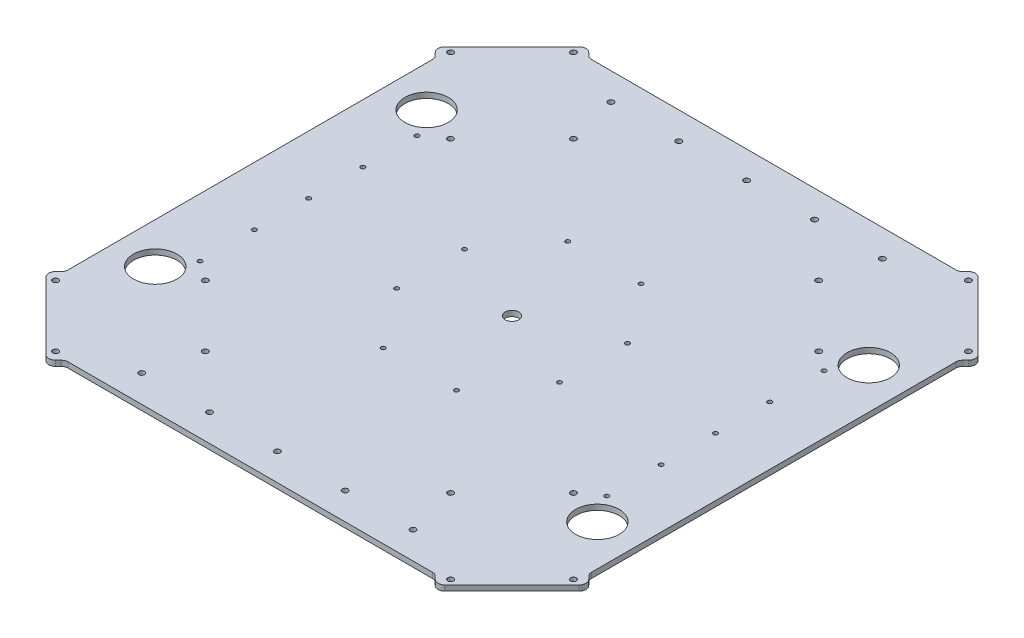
SolidWorks part; units mm, degrees
ref_plane "前视基准面" through (0, 0, 0) normal (0, 0, 1) x (1, 0, 0)
ref_plane "上视基准面" through (0, 0, 0) normal (0, 1, 0) x (1, 0, 0)
ref_plane "右视基准面" through (0, 0, 0) normal (1, 0, 0) x (0, 0, -1)
sketch "草图1" plane through (0, 0, 0) normal (0, 1, 0) x (1, 0, 0)
  line L0 (-143.4315, 200) -> (-200, 143.4315)
  line L1 (-200, 200) -> (200, 200)
  line L2 (-200, 200) -> (-200, -200)
  line L3 (-200, -200) -> (200, -200)
  line L4 (200, 200) -> (200, -200)
  line L5 (-200, 200) -> (200, -200) construction
  line L6 (-200, -200) -> (200, 200) construction
  line L7 (200, 143.4315) -> (143.4315, 200)
  line L8 (143.4315, -200) -> (200, -143.4315)
  line L9 (-200, -143.4315) -> (-143.4315, -200)
  point P17 (0, 0)
  dimension "D1" = 400
  dimension "D2" = 400
  dimension "D3" = 45
  dimension "D4" = 4
  dimension "D5" = 40
extrude "凸台-拉伸1" add sketch "草图1" along normal blind 4 contours L2 L9 L3 L8 L4 L7 L1 L0
sketch "草图2" plane through (0, 4, 0) normal (0, 1, 0) x (1, 0, 0)
  line L0 (-145.5528, 190.8076) -> (-190.8076, 145.5528) construction
  line L1 (-143.4315, 200) -> (-200, 143.4315) construction
  line L2 (-171.7157, 171.7157) -> (-94.1279, 94.1279) construction
  line L3 (-90.3984, 135.6533) -> (-135.6533, 90.3984) construction
  line L4 (190.8076, 145.5528) -> (145.5528, 190.8076) construction
  line L5 (171.7157, 171.7157) -> (94.1279, 94.1279) construction
  line L6 (135.6533, 90.3984) -> (90.3984, 135.6533) construction
  line L7 (145.5528, -190.8076) -> (190.8076, -145.5528) construction
  line L8 (171.7157, -171.7157) -> (94.1279, -94.1279) construction
  line L9 (90.3984, -135.6533) -> (135.6533, -90.3984) construction
  line L10 (-190.8076, -145.5528) -> (-145.5528, -190.8076) construction
  line L11 (-171.7157, -171.7157) -> (-94.1279, -94.1279) construction
  line L12 (-135.6533, -90.3984) -> (-90.3984, -135.6533) construction
  circle A0 centre (-190.8076, 145.5528) radius 2.1
  circle A1 centre (-145.5528, 190.8076) radius 2.1
  circle A2 centre (-135.6533, 90.3984) radius 2.1
  circle A3 centre (-90.3984, 135.6533) radius 2.1
  circle A4 centre (145.5528, 190.8076) radius 2.1
  circle A5 centre (190.8076, 145.5528) radius 2.1
  circle A6 centre (90.3984, 135.6533) radius 2.1
  circle A7 centre (135.6533, 90.3984) radius 2.1
  circle A8 centre (190.8076, -145.5528) radius 2.1
  circle A9 centre (145.5528, -190.8076) radius 2.1
  circle A10 centre (135.6533, -90.3984) radius 2.1
  circle A11 centre (90.3984, -135.6533) radius 2.1
  circle A12 centre (-145.5528, -190.8076) radius 2.1
  circle A13 centre (-190.8076, -145.5528) radius 2.1
  circle A14 centre (-90.3984, -135.6533) radius 2.1
  circle A15 centre (-135.6533, -90.3984) radius 2.1
  point P8 (-168.1802, 168.1802)
  point P46 (0, 0)
  dimension "D1" = 4.2
  dimension "D2" = 4.2
  dimension "D3" = 5
  dimension "D4" = 64
  dimension "D6" = 78
  dimension "D8" = 78
  dimension "D5" = 2
  dimension "D7" = 4
extrude "切除-拉伸1" cut sketch "草图2" against normal through all
sketch "草图3" plane through (0, 4, 0) normal (0, 1, 0) x (1, 0, 0)
  line L0 (-200, 143.4315) -> (-192.9289, 136.3604)
  line L1 (-192.9289, 136.3604) -> (-192.9289, -136.3604)
  line L2 (0, 0) -> (-200, 0) construction
  line L3 (-200, 143.4315) -> (-200, -143.4315) construction
  line L4 (-200, -143.4315) -> (-192.9289, -136.3604)
  line L5 (143.4315, 200) -> (136.3604, 192.9289)
  line L6 (136.3604, 192.9289) -> (-136.3604, 192.9289)
  line L7 (-143.4315, 200) -> (-136.3604, 192.9289)
  line L8 (200, -143.4315) -> (192.9289, -136.3604)
  line L9 (192.9289, -136.3604) -> (192.9289, 136.3604)
  line L10 (200, 143.4315) -> (192.9289, 136.3604)
  line L11 (-143.4315, -200) -> (-136.3604, -192.9289)
  line L12 (-136.3604, -192.9289) -> (136.3604, -192.9289)
  line L13 (143.4315, -200) -> (136.3604, -192.9289)
  line L22 (-200, 143.4315) -> (-200, -143.4315)
  line L23 (-200, -143.4315) -> (-143.4315, -200)
  line L24 (-143.4315, -200) -> (143.4315, -200)
  line L25 (143.4315, -200) -> (200, -143.4315)
  line L26 (200, -143.4315) -> (200, 143.4315)
  line L27 (200, 143.4315) -> (143.4315, 200)
  line L28 (143.4315, 200) -> (-143.4315, 200)
  line L29 (-143.4315, 200) -> (-200, 143.4315)
  line L30 (-200, 143.4315) -> (-200, -143.4315)
  line L32 (-143.4315, -200) -> (143.4315, -200)
  line L34 (200, -143.4315) -> (200, 143.4315)
  line L36 (143.4315, 200) -> (-143.4315, 200)
  point P10 (-192.9289, 0)
  point P18 (0, 192.9289)
  point P23 (192.9289, 0)
  point P28 (0, -192.9289)
  point P29 (0, 0)
  dimension "D1" = 10
  dimension "D3" = 0
  dimension "D2" = 4
extrude "切除-拉伸2" cut sketch "草图3" against normal through all
sketch "草图4" plane through (0, 4, 0) normal (0, 1, 0) x (1, 0, 0)
  circle A0 centre (0, 0) radius 5
  dimension "D1" = 10
extrude "切除-拉伸3" cut sketch "草图4" against normal through all
sketch "草图5" plane through (0, 0, 0) normal (0, -1, 0) x (1, 0, 0)
  line L0 (0, 192.9289) -> (0, -192.9289) construction
  line L1 (136.3604, 192.9289) -> (-136.3604, 192.9289) construction
  line L2 (-136.3604, -192.9289) -> (136.3604, -192.9289) construction
  line L5 (192.9289, -136.3604) -> (192.9289, 136.3604) construction
  circle A0 centre (162.9289, 100) radius 16
  circle A1 centre (162.9289, -100) radius 16
  circle A4 centre (-162.9289, -100) radius 16
  circle A5 centre (-162.9289, 100) radius 16
  dimension "D1" = 32
  dimension "D2" = 32
  dimension "D3" = 200
  dimension "D4" = 30
extrude "切除-拉伸4" cut sketch "草图5" against normal through all
sketch "草图6" plane through (0, 0, 0) normal (0, -1, 0) x (1, 0, 0)
  line L1 (0, 192.9289) -> (0, -192.9289) construction
  line L2 (136.3604, 192.9289) -> (-136.3604, 192.9289) construction
  line L3 (-136.3604, -192.9289) -> (136.3604, -192.9289) construction
  circle A0 centre (-149.9289, 80) radius 1.6
  circle A11 centre (-162.9289, 100) radius 16 construction
  circle A12 centre (-149.9289, 40) radius 1.6
  circle A13 centre (-149.9289, 0) radius 1.6
  circle A14 centre (-149.9289, -40) radius 1.6
  circle A15 centre (-149.9289, -80) radius 1.6
  circle A16 centre (149.9289, -80) radius 1.6
  circle A17 centre (149.9289, -40) radius 1.6
  circle A18 centre (149.9289, 0) radius 1.6
  circle A19 centre (149.9289, 40) radius 1.6
  circle A20 centre (149.9289, 80) radius 1.6
  dimension "D1" = 3.2
  dimension "D3" = 13
  dimension "D2" = 20
  dimension "D4" = 5
extrude "切除-拉伸5" cut sketch "草图6" against normal through all
sketch "草图7" plane through (0, 4, 0) normal (0, 1, 0) x (1, 0, 0)
  line L0 (0, 192.9289) -> (0, -192.9289) construction
  line L1 (-136.3604, 192.9289) -> (136.3604, 192.9289) construction
  line L2 (136.3604, -192.9289) -> (-136.3604, -192.9289) construction
  line L3 (0, 0) -> (192.9289, 0) construction
  line L4 (192.9289, 136.3604) -> (192.9289, -136.3604) construction
  circle A0 centre (0, 172.9289) radius 2.1
  circle A1 centre (50, 172.9289) radius 2.1
  circle A2 centre (100, 172.9289) radius 2.1
  circle A3 centre (-100, 172.9289) radius 2.1
  circle A4 centre (-50, 172.9289) radius 2.1
  circle A5 centre (-50, -172.9289) radius 2.1
  circle A6 centre (-100, -172.9289) radius 2.1
  circle A7 centre (100, -172.9289) radius 2.1
  circle A8 centre (50, -172.9289) radius 2.1
  circle A9 centre (0, -172.9289) radius 2.1
  circle A11 centre (150, 172.9289) radius 2.1
  dimension "D1" = 4.2
  dimension "D2" = 20
  dimension "D3" = 4
extrude "切除-拉伸6" cut sketch "草图7" against normal through all
sketch "草图8" plane through (0, 4, 0) normal (0, 1, 0) x (1, 0, 0)
  line L0 (0, 0) -> (106.1547, 0) construction
  line L1 (0, 0) -> (0, 108.5295) construction
  circle A0 centre (60, 25) radius 1.6
  circle A1 centre (27, 68) radius 1.6
  circle A2 centre (27, -68) radius 1.6
  circle A3 centre (60, -25) radius 1.6
  circle A4 centre (-60, -25) radius 1.6
  circle A5 centre (-27, -68) radius 1.6
  circle A6 centre (-27, 68) radius 1.6
  circle A7 centre (-60, 25) radius 1.6
  dimension "D1" = 50
  dimension "D2" = 27
  dimension "D3" = 43
  dimension "D4" = 60
  dimension "D5" = 3.2
  dimension "D6" = 3.2
extrude "切除-拉伸7" cut sketch "草图8" against normal blind 10
sketch "草图9" plane through (0, 4, 0) normal (0, 1, 0) x (1, 0, 0)
  circle A0 centre (0, 0) radius 75
  dimension "D1" = 150
fillet "圆角1" radius 5 16 edges at (-192.9289, 2, 136.3604) (-200, 2, 143.4315) (-143.4315, 2, 200) (-136.3604, 2, 192.9289) (136.3604, 2, 192.9289) (143.4315, 2, 200) (200, 2, 143.4315) (192.9289, 2, 136.3604) (192.9289, 2, -136.3604) (200, 2, -143.4315) (143.4315, 2, -200) (136.3604, 2, -192.9289) (-136.3604, 2, -192.9289) (-143.4315, 2, -200) (-200, 2, -143.4315) (-192.9289, 2, -136.3604)
